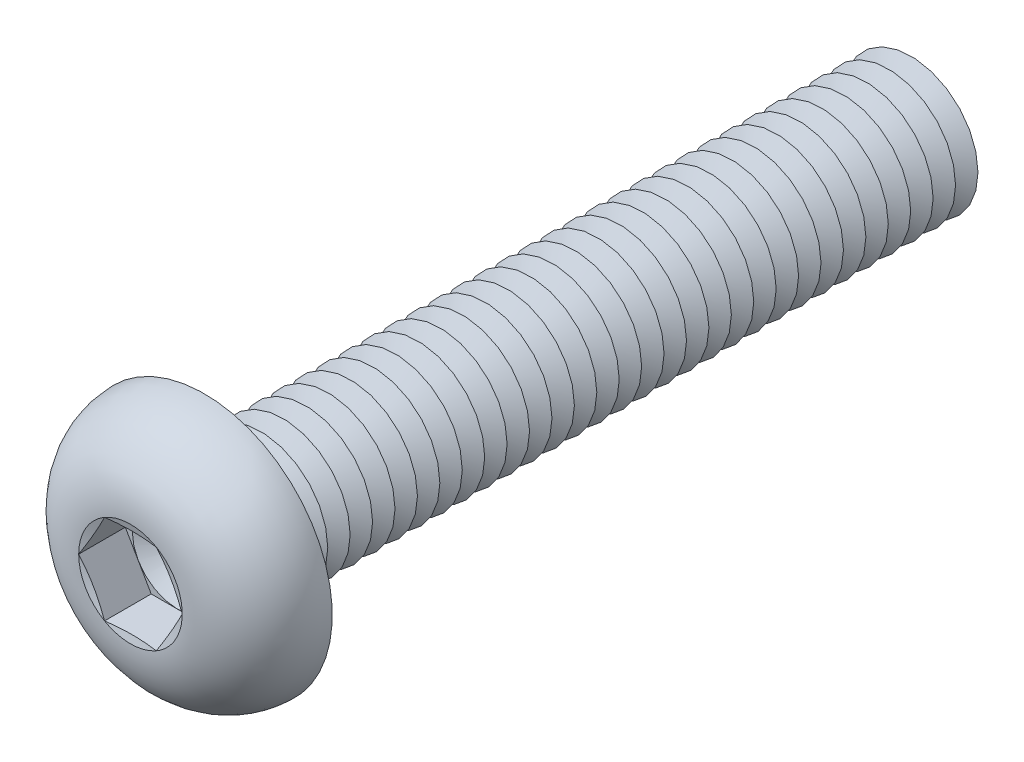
SolidWorks part; units mm, degrees
ref_plane "Front Plane" through (0, 0, 0) normal (0, 0, 1) x (1, 0, 0)
ref_plane "Top Plane" through (0, 0, 0) normal (0, 1, 0) x (1, 0, 0)
ref_plane "Right Plane" through (0, 0, 0) normal (1, 0, 0) x (0, 0, -1)
sketch "Sketch1" plane through (0, 0, 0) normal (1, 0, 0) x (0, 0, -1)
  line L0 (0, 1.5) -> (0, 2.85)
  line L3 (0, 1.5) -> (16, 1.5)
  line L4 (16, 1.5) -> (16, 0)
  line L5 (16, 0) -> (-1.65, 0) construction
  line L6 (-1.65, 0) -> (16, 0)
  line L7 (-1.65, 1.1547) -> (-1.65, 0.5773) construction
  line L8 (-1.65, 0.5773) -> (-1.65, 0)
  line L9 (-1.65, 1.1547) -> (-1.4953, 0.5773)
  line L10 (-1.4953, 0.5773) -> (-1.65, 0.5773)
  line L11 (16, 0) -> (22.7481, 0) construction
  line L12 (0, 2.85) -> (-1.65, 2.85) construction
  arc A1 (0, 2.85) -> (-1.65, 1.1547) centre (0, 1.1994) ccw
  point P8 (16, 0.75)
  dimension "D1" = 5.7
  dimension "D2" = 3
  dimension "D3" = 1.65
  dimension "D4" = 2.3094
  dimension "D5" = 16
  dimension "D6" = 15
revolve "Revolve1" add sketch "Sketch1" angle 360 about L5
fillet "Fillet1" radius 0.25 1 edges at (-1.5, 0, 0)
sketch "Sketch2" plane through (0, 0, 0) normal (1, 0, 0) x (0, 0, -1)
  line L0 (15.75, 1.5) -> (16.25, 1.5)
  line L1 (16, 1.5) -> (0.25, 1.5) construction
  line L2 (16.25, 1.5) -> (16, 1.067)
  line L3 (16, -1.5) -> (16, 1.5) construction
  line L4 (16, 1.067) -> (15.75, 1.5)
  dimension "D1" = 0.5
revolve "Cut-Revolve1" cut sketch "Sketch2" angle 360 about axis through (0, 0, -16) along (0, 0, -1)
pattern_linear "LPattern1" count 32 spacing 0.5 along (0, 0, 1) of "Cut-Revolve1"
sketch "Sketch3" plane through (0, 0, 1.65) normal (0, 0, 1) x (1, 0, 0)
  line L7 (0.5773, 1) -> (-0.5774, 1)
  line L8 (-0.5774, 1) -> (-1.1547, 0)
  line L9 (-1.1547, 0) -> (-0.5773, -1)
  line L10 (-0.5773, -1) -> (0.5773, -1)
  line L11 (0.5773, -1) -> (1.1547, 0)
  line L12 (1.1547, 0) -> (0.5773, 1)
  circle A0 centre (0, 0) radius 1 construction
  circle A3 centre (0, 0) radius 1.1547 construction
extrude "Cut-Extrude1" cut sketch "Sketch3" against normal blind 1.04
sketch "Sketch4" plane through (0, 0, 0.61) normal (0, 0, 1) x (1, 0, 0)
  line L1 (0.5773, 1) -> (-0.5774, 1) construction
  circle A0 centre (0, 0) radius 1
extrude "Cut-Extrude2" cut sketch "Sketch4" against normal through all draft 60
